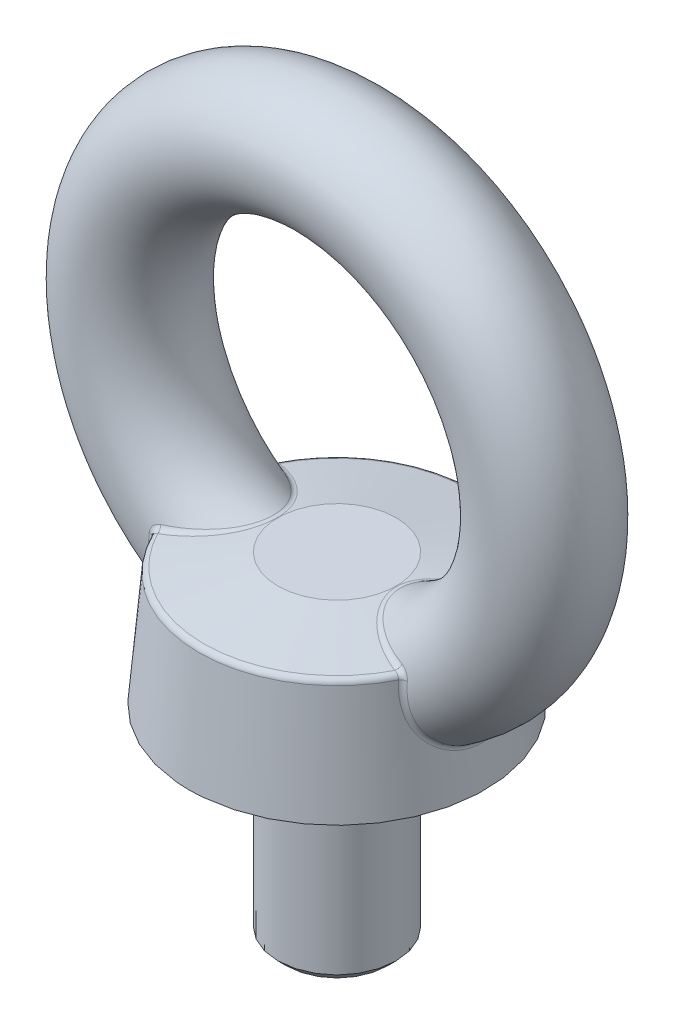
SolidWorks part; units mm, degrees
ref_plane "Front Plane" through (0, 0, 0) normal (0, 0, 1) x (1, 0, 0)
ref_plane "Top Plane" through (0, 0, 0) normal (0, 1, 0) x (1, 0, 0)
ref_plane "Right Plane" through (0, 0, 0) normal (1, 0, 0) x (0, 0, -1)
sketch "Sketch1" plane through (0, 0, 0) normal (0, 0, 1) x (1, 0, 0)
  ellipse E0 centre (0, 22.5) end of major axis (0, 0) minor radius 22.5
  dimension "D1" = 45
  dimension "D2" = 45
sketch "Sketch2" plane through (0, 0, 0) normal (1, 0, 0) x (0, 0, -1)
  line L3 (0, 45) -> (0, 0) construction
  circle A0 centre (0, 5) radius 5
  point P5 (0, 0)
sweep "Sweep1" add profiles "Sketch2" path "Sketch1"
sketch "Sketch3" plane through (0, 0, 0) normal (1, 0, 0) x (0, 0, -1)
  line L0 (0, 0) -> (-12.5, 0)
  line L1 (-12.5, 0) -> (-11.6251, 10)
  line L2 (-11.6251, 10) -> (-5, 11.1682)
  line L3 (-5, 11.1682) -> (0, 11.1682)
  line L4 (0, 11.1682) -> (0, 0)
revolve "Revolve1" add sketch "Sketch3" angle 360 about L4
fillet "Fillet1" radius 0.5 6 edges at (5.2359, 11.1225, 0.4939) (12.1698, 3.6155, -0.5804) (-5.2359, 11.1225, -0.4939) (-12.1744, 3.6073, -0.494) (0, 10, -11.6251) (0, 10, 11.6251)
sketch "Sketch4" plane through (0, 0, 0) normal (0, -1, 0) x (1, 0, 0)
  circle A0 centre (0, 0) radius 5
  dimension "D1" = 10
extrude "Extrude1" add sketch "Sketch4" along normal blind 17
chamfer "Chamfer1" distance 0.75 angle 45 1 edges at (0, -17, -5)
sketch "Sketch5" plane through (0, 0, 0) normal (1, 0, 0) x (0, 0, -1)
  line L0 (-5, 0) -> (-5, -2.049)
  line L1 (-5, 0) -> (-5, -16.25) construction
  line L2 (-4.25, -0.75) -> (-5, -2.049)
  line L3 (-4.25, -0.75) -> (-4.25, -0.375)
  line L4 (-4.625, 0) -> (-5, 0)
  line L5 (-4.625, -0.375) -> (-4.25, -0.375) construction
  arc A1 (-4.25, -0.375) -> (-4.625, 0) centre (-4.625, -0.375) ccw
  point P0 (-4.25, -17)
  dimension "D1" = 30
revolve "Cut-Revolve1" cut sketch "Sketch5" angle 360 about axis through (0, -17, 0) along (0, 1, 0)
equation "\"D4@Sketch3\" = \"D1@Sketch2\""
equation "\"D5@Sketch3\" = \"D1@Sketch2\"/2"
